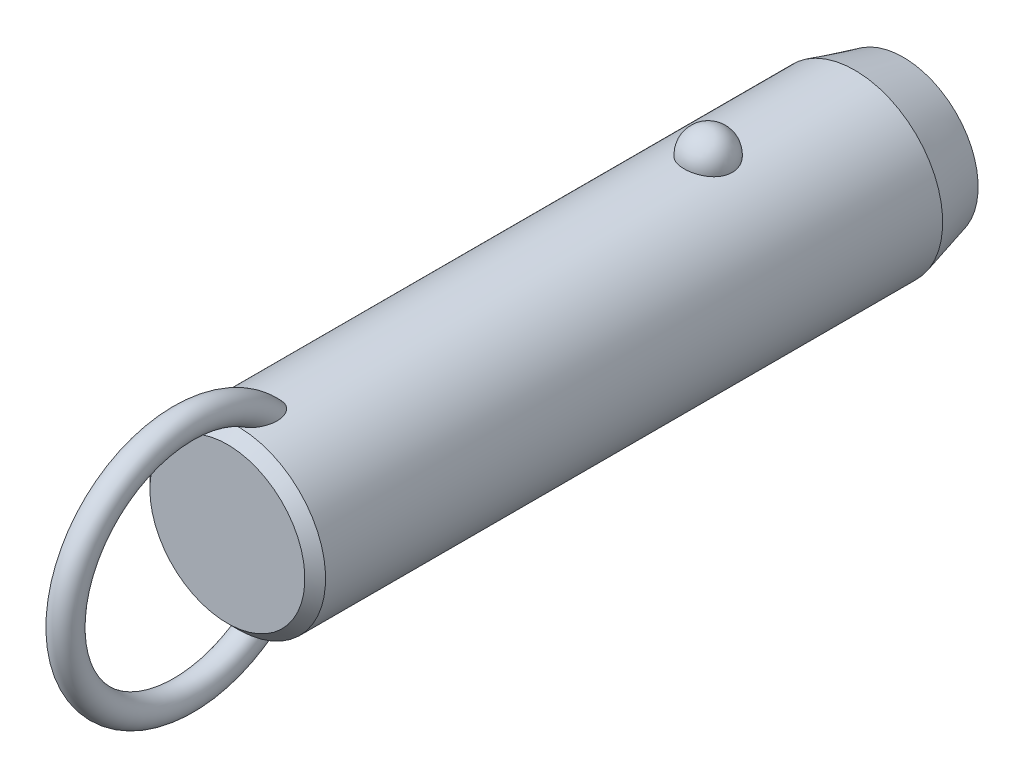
SolidWorks part; units mm, degrees
ref_plane "Front Plane" through (0, 0, 0) normal (0, 0, 1) x (1, 0, 0)
ref_plane "Top Plane" through (0, 0, 0) normal (0, 1, 0) x (1, 0, 0)
ref_plane "Right Plane" through (0, 0, 0) normal (1, 0, 0) x (0, 0, -1)
sketch "Sketch2" plane through (0, 0, 0) normal (0, 0, 1) x (1, 0, 0)
  circle A0 centre (0, 0) radius 12.7
  point P3 (0, 12.7)
  dimension "D1" = 25.4
extrude "Boss-Extrude1" add sketch "Sketch2" along normal blind 53.3
sketch "Sketch3" plane through (0, 0, 0) normal (0, 0, -1) x (-1, 0, 0)
  circle A0 centre (0, 0) radius 12.7
  dimension "D1" = 25.4
extrude "Boss-Extrude2" add sketch "Sketch3" along normal blind 31.7
chamfer "Chamfer1" distance 7 angle 15 1 edges at (-12.7, 0, -31.7)
sketch "Sketch12" plane through (0, 0, 0) normal (1, 0, 0) x (0, 0, -1)
  line L0 (-53.3, 12.7) -> (-53.3, -12.7) construction
  point P0 (-53.3, 0)
sketch "Sketch13" plane through (0, 0, 0) normal (1, 0, 0) x (0, 0, -1)
  circle A0 centre (-72.35, 0) radius 19.05
  point P2 (-53.3, 0)
  dimension "D1" = 38.1
sketch "Sketch14" plane through (0, 0, 0) normal (0, 1, 0) x (1, 0, 0)
  circle A0 centre (0, -55.3) radius 2
  point P2 (0, -53.3)
  dimension "D1" = 4
sweep "Sweep1" add profiles "Sketch14" path "Sketch13"
sketch "Sketch15" plane through (0, 0, 53.3) normal (0, 0, 1) x (1, 0, 0)
  circle A0 centre (0, 0) radius 12.7
  dimension "D1" = 25.4
extrude "Boss-Extrude3" add sketch "Sketch15" along normal blind 12.7
chamfer "Chamfer2" distance 1.5 angle 45 1 edges at (12.7, 0, 66)
sketch "Sketch18" plane through (0, 0, 0) normal (1, 0, 0) x (0, 0, -1)
  line L0 (24.7, 12.7) -> (-58.151, 12.7) construction
  line L1 (3.5, 16.2) -> (3.5, 9.2)
  line L2 (-58.151, -12.7) -> (24.7, -12.7) construction
  arc A0 (3.5, 16.2) -> (3.5, 9.2) centre (3.5, 12.7) ccw
  point P4 (0, 12.7)
  dimension "D1" = 28.9
revolve "Revolve1" add sketch "Sketch18" angle 360 about L1
